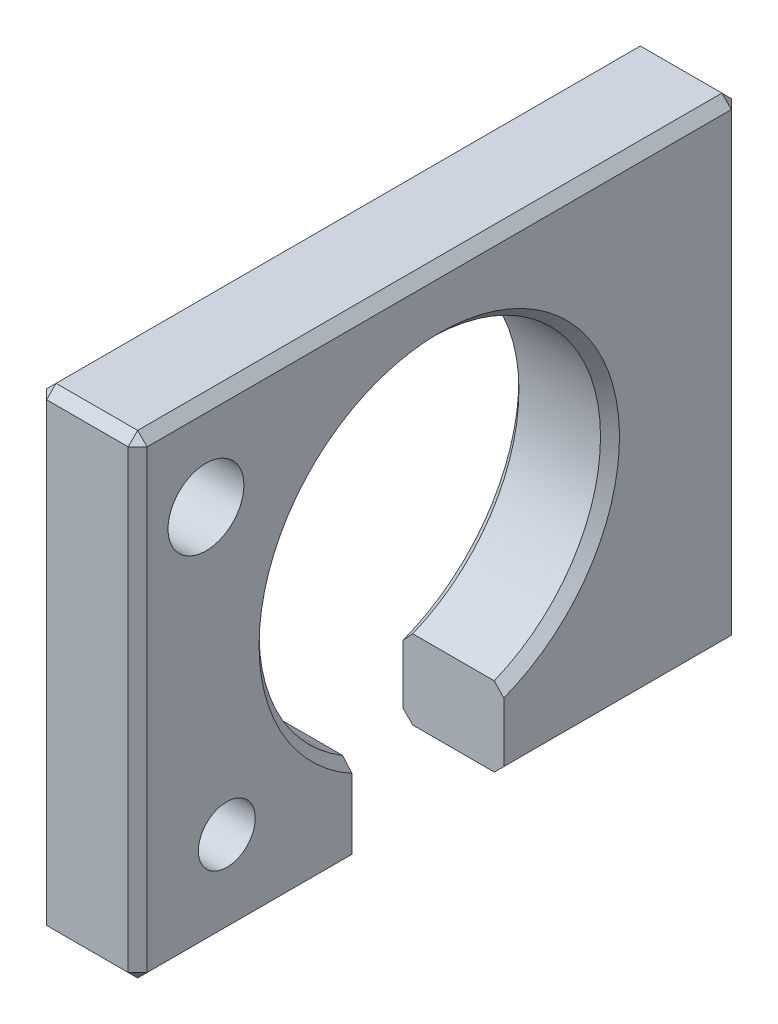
SolidWorks part; units mm, degrees
ref_plane "Face" through (0, 0, 0) normal (0, 0, 1) x (1, 0, 0)
ref_plane "Dessus" through (0, 0, 0) normal (0, 1, 0) x (1, 0, 0)
ref_plane "Droite" through (0, 0, 0) normal (1, 0, 0) x (0, 0, -1)
sketch "Esquisse1" plane through (0, 0, 0) normal (1, 0, 0) x (0, 0, -1)
  line L0 (-37.5664, 0) -> (34.0445, 0) construction
  line L1 (0, 31.501) -> (0, -26.8052) construction
  line L2 (3.4, -8.3331) -> (3.4, -12.5)
  line L3 (-15.9, 12.5) -> (15.9, 12.5)
  line L4 (-15.9, 12.5) -> (-15.9, -12.5)
  line L5 (-15.9, -12.5) -> (-4.6, -12.5)
  line L6 (15.9, 12.5) -> (15.9, -12.5)
  line L7 (-4.6, -7.7356) -> (-4.6, -12.5)
  line L8 (3.4, -12.5) -> (15.9, -12.5)
  arc A0 (3.4, -8.3331) -> (-4.6, -7.7356) centre (0, 0) ccw
  dimension "D3" = 18
  dimension "D1" = 31.8
  dimension "D2" = 25
  dimension "D4" = 3.4
  dimension "D5" = 8
extrude "Base-Extrusion" add sketch "Esquisse1" along normal mid plane 5.3
sketch "Esquisse2" plane through (2.65, 0, 0) normal (1, 0, 0) x (0, 0, -1)
  circle A0 centre (-11.2, -7.8) radius 1.5
  circle A1 centre (-12.3, 7.7) radius 2
  dimension "D5" = 4
  dimension "D6" = 3
  dimension "D1" = 11.2
  dimension "D2" = 7.8
  dimension "D3" = 7.7
  dimension "D4" = 12.3
extrude "Enlèv. mat.-Extru.1" cut sketch "Esquisse2" against normal up to next
chamfer "Chanfrein1" distance 0.5 angle 45 16 edges at (-2.65, -12.5, 10.25) (-2.65, 0, 15.9) (2.65, 8.975, -0.6702) (0, 12.5, 15.9) (0, 12.5, -15.9) (0, -12.5, -15.9) (0, -12.5, 15.9) (2.65, -12.5, -9.65) (2.65, 0, -15.9) (2.65, 12.5, 0) (2.65, 0, 15.9) (2.65, -12.5, 10.25) (-2.65, 12.5, 0) (-2.65, 0, -15.9) (-2.65, -12.5, -9.65) (-2.65, 8.975, -0.6702)
